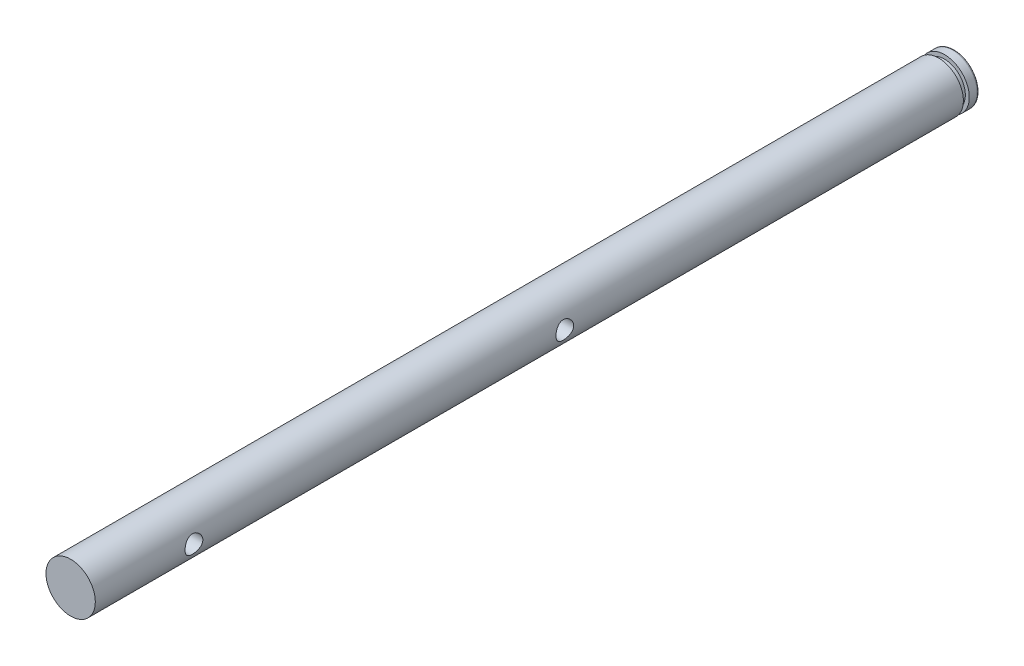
SolidWorks part; units mm, degrees
ref_plane "Front Plane" through (0, 0, 0) normal (0, 0, 1) x (1, 0, 0)
ref_plane "Top Plane" through (0, 0, 0) normal (0, 1, 0) x (1, 0, 0)
ref_plane "Right Plane" through (0, 0, 0) normal (1, 0, 0) x (0, 0, -1)
sketch "Sketch1" plane through (0, 0, 0) normal (0, 0, 1) x (1, 0, 0)
  circle A0 centre (0, 0) radius 3.175
  dimension "D1" = 6.35
extrude "Boss-Extrude1" add sketch "Sketch1" along normal blind 113.792
sketch "Sketch2" plane through (0, 0, 0) normal (1, 0, 0) x (0, 0, -1)
  line L0 (-113.792, 3.175) -> (-113.792, -3.175) construction
  circle A0 centre (-101.092, 0) radius 1.143
  circle A1 centre (-53.34, 0) radius 1.143
  dimension "D1" = 2.286
  dimension "D2" = 12.7
  dimension "D3" = 60.452
extrude "Cut-Extrude1" cut sketch "Sketch2" against normal through all and the other way through all
sketch "Sketch3" plane through (0, 0, 0) normal (1, 0, 0) x (0, 0, -1)
  line L0 (0, 3.175) -> (-113.792, 3.175) construction
  line L1 (-2.032, 3.175) -> (-1.27, 3.175)
  line L2 (-2.032, 3.175) -> (-2.032, 2.667)
  line L3 (-2.032, 2.667) -> (-1.27, 2.667)
  line L4 (-1.27, 3.175) -> (-1.27, 2.667)
  line L5 (0, -3.175) -> (0, 3.175) construction
  line L6 (0, 0) -> (-15.5669, 0) construction
  dimension "D1" = 0.762
  dimension "D2" = 0.508
  dimension "D3" = 1.27
revolve "Cut-Revolve1" cut sketch "Sketch3" angle 360 about L6
fillet "Fillet1" radius 0.254 1 edges at (3.175, 0, 0)
